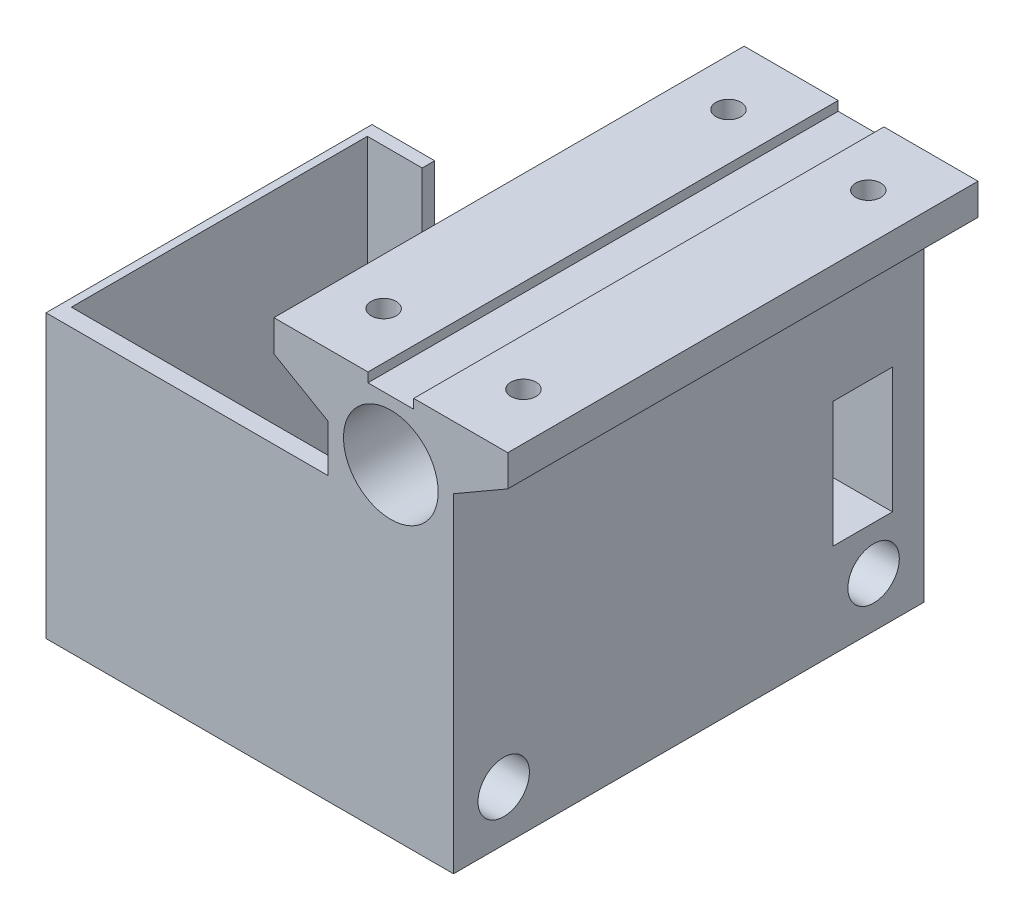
SolidWorks part; units mm, degrees
ref_plane "Alzado" through (0, 0, 0) normal (0, 0, 1) x (1, 0, 0)
ref_plane "Planta" through (0, 0, 0) normal (0, 1, 0) x (1, 0, 0)
ref_plane "Vista lateral" through (0, 0, 0) normal (1, 0, 0) x (0, 0, -1)
sketch "Croquis1" plane through (0, 0, 0) normal (0, 0, 1) x (1, 0, 0)
  line L0 (-3.65, 11) -> (-3.65, 9.5)
  line L2 (-10, 1.0059) -> (-10, -51.5)
  line L3 (-10, -51.5) -> (10, -51.5)
  line L4 (10, 1.0059) -> (10, -51.5)
  line L5 (-3.65, 9.5) -> (3.65, 9.5)
  line L6 (3.65, 9.5) -> (3.65, 11)
  line L8 (0, 0) -> (0, 16.9033) construction
  line L9 (-3.65, 11) -> (-18.65, 11)
  line L10 (-18.65, 11) -> (-18.65, 6)
  line L11 (-18.65, 6) -> (-10, 1.0059)
  line L12 (18.65, 6) -> (10, 1.0059)
  line L13 (18.65, 11) -> (18.65, 6)
  line L14 (3.65, 11) -> (18.65, 11)
  circle A0 centre (0, 0) radius 4.1 construction
  circle A1 centre (0, 0) radius 7.55
  point P6 (0, 0)
  point P14 (0, 0)
  point P17 (0, 0)
  dimension "D1" = 8.2
  dimension "D5" = 15.1
  dimension "D2" = 1.5
  dimension "D3" = 7.3
  dimension "D4" = 62.5
  dimension "D6" = 20
  dimension "D7" = 11
  dimension "D8" = 5
  dimension "D9" = 15
  dimension "D10" = 60
extrude "Saliente-Extruir1" add sketch "Croquis1" along normal blind 75
sketch "Croquis2" plane through (10, 0, 0) normal (1, 0, 0) x (0, 0, -1)
  line L0 (-75, -51.5) -> (0, -51.5) construction
  line L1 (-75, 11) -> (0, 11) construction
  line L2 (0, -51.5) -> (0, 1.0059) construction
  line L4 (-37.5, 11) -> (-37.5, -51.5) construction
  line L5 (-61.1, -46.5) -> (-13.9, -46.5) construction
  line L6 (-61.1, -46.5) -> (-61.1, -4.2) construction
  line L7 (-61.1, -4.2) -> (-13.9, -4.2) construction
  line L8 (-13.9, -46.5) -> (-13.9, -4.2) construction
  line L15 (-75, -51.5) -> (-75, 1.0059) construction
  circle A0 centre (-67, -43.5) radius 4.1
  circle A1 centre (-8, -43.5) radius 4.1
  point P8 (-37.5, 11)
  dimension "D1" = 8.2
  dimension "D2" = 8.2
  dimension "D3" = 8
  dimension "D5" = 8
  dimension "D7" = 8
  dimension "D8" = 8
  dimension "D9" = 47.2
  dimension "D10" = 42.3
  dimension "D11" = 5
  dimension "D12" = 23.6
extrude "Cortar-Extruir1" cut sketch "Croquis2" against normal blind 10 contours A1 | A0
sketch "Croquis3" plane through (-10, 0, 0) normal (-1, 0, 0) x (0, 0, 1)
  line L0 (75, 1.0059) -> (75, -51.5) construction
  line L1 (75, -6.5) -> (23, -6.5)
  line L2 (75, -6.5) -> (75, -51.5)
  line L3 (75, -51.5) -> (23, -51.5)
  line L4 (23, -6.5) -> (23, -51.5)
  line L5 (75, -51.5) -> (0, -51.5) construction
  dimension "D1" = 52
  dimension "D2" = 45
extrude "Saliente-Extruir2" add sketch "Croquis3" along normal blind 45
sketch "Croquis4" plane through (0, -6.5, 0) normal (0, 1, 0) x (1, 0, 0)
  line L0 (-55, -23) -> (-10, -23) construction
  line L1 (-53.75, -25) -> (-45, -25)
  line L2 (-53.75, -25) -> (-53.75, -72.2)
  line L3 (-53.75, -72.2) -> (-11.25, -72.2)
  line L4 (-11.25, -25) -> (-11.25, -72.2)
  line L5 (-45, -23) -> (-20, -23)
  line L6 (-45, -23) -> (-45, -25)
  line L8 (-20, -23) -> (-20, -25)
  line L9 (-32.5, -23) -> (-32.5, -75) construction
  line L10 (-55, -75) -> (-10, -75) construction
  line L11 (-20, -25) -> (-11.25, -25)
  dimension "D1" = 25
  dimension "D2" = 42.5
  dimension "D3" = 47.2
  dimension "D4" = 2
extrude "Cortar-Extruir3" cut sketch "Croquis4" against normal offset from surface (42 mm away) 3 contours L1 L6 L5 L8 L11 L4 L3 L2
sketch "Croquis5" plane through (-10, 0, 0) normal (-1, 0, 0) x (0, 0, 1)
  line L0 (23, -6.5) -> (23, -51.5) construction
  line L1 (5, -16.5) -> (14.5, -16.5)
  line L2 (5, -16.5) -> (5, -36.5)
  line L3 (5, -36.5) -> (14.5, -36.5)
  line L4 (14.5, -16.5) -> (14.5, -36.5)
  line L5 (5, -26.5) -> (14.5, -26.5) construction
  line L6 (23, -51.5) -> (0, -51.5) construction
  dimension "D1" = 8.5
  dimension "D2" = 9.5
  dimension "D3" = 20
  dimension "D4" = 25
extrude "Cortar-Extruir4" cut sketch "Croquis5" against normal through all contours L1 L4 L3 L2
sketch "Croquis6" plane through (0, 11, 0) normal (0, 1, 0) x (1, 0, 0)
  line L4 (-3.65, 0) -> (-18.65, 0) construction
  line L5 (18.65, 0) -> (3.65, 0) construction
  line L6 (18.65, -75) -> (3.65, -75) construction
  line L7 (-11.15, 0) -> (-11.15, -75) construction
  line L8 (11.15, 0) -> (11.15, -75) construction
  line L9 (-3.65, -75) -> (-18.65, -75) construction
  circle A0 centre (11.15, -10) radius 2
  circle A1 centre (-11.15, -10) radius 2
  circle A2 centre (-11.15, -65) radius 2
  circle A3 centre (11.15, -65) radius 2
  point P18 (-11.15, 0)
  point P21 (11.15, 0)
  dimension "D1" = 4
  dimension "D2" = 4
  dimension "D3" = 4
  dimension "D4" = 4
  dimension "D5" = 10
  dimension "D6" = 10
  dimension "D7" = 10
  dimension "D8" = 10
extrude "Cortar-Extruir5" cut sketch "Croquis6" against normal blind 5
